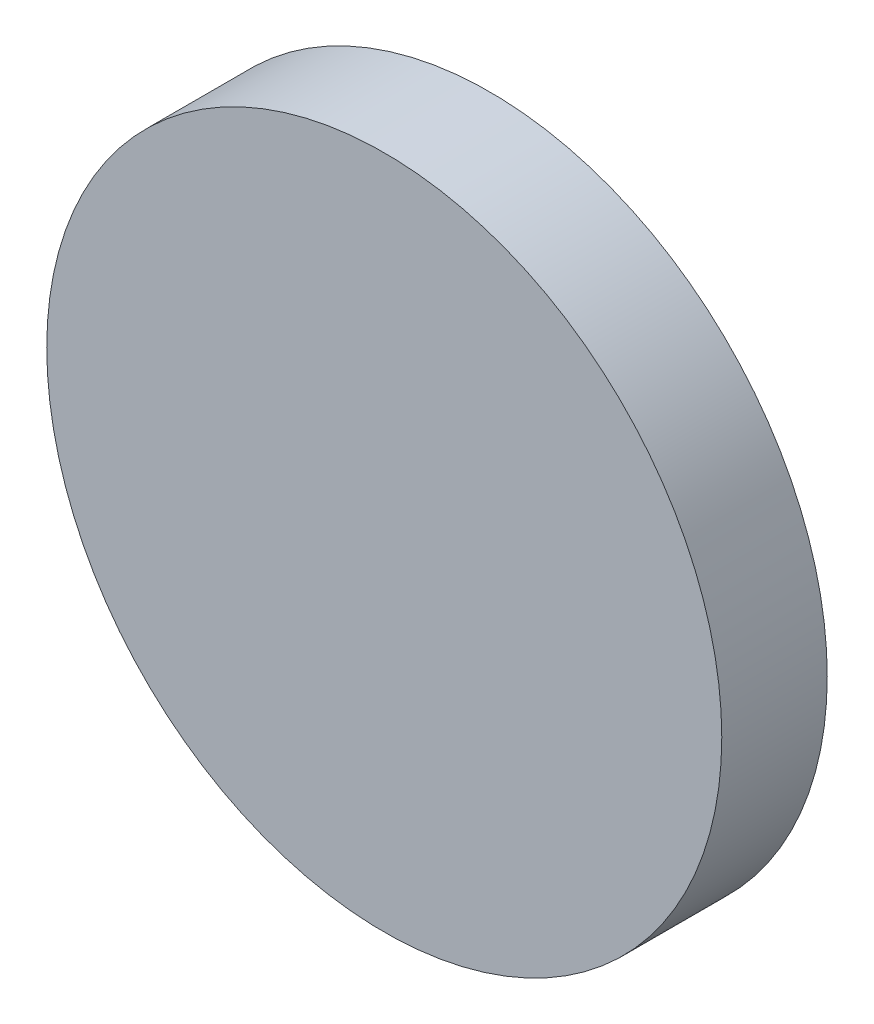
SolidWorks part; units mm, degrees
ref_plane "Front Plane" through (0, 0, 0) normal (0, 0, 1) x (1, 0, 0)
ref_plane "Top Plane" through (0, 0, 0) normal (0, 1, 0) x (1, 0, 0)
ref_plane "Right Plane" through (0, 0, 0) normal (1, 0, 0) x (0, 0, -1)
sketch "Sketch1" plane through (0, 0, 0) normal (0, 0, 1) x (1, 0, 0)
  circle A0 centre (0, 0) radius 6.4
extrude "Boss-Extrude1" add sketch "Sketch1" along normal blind 2
